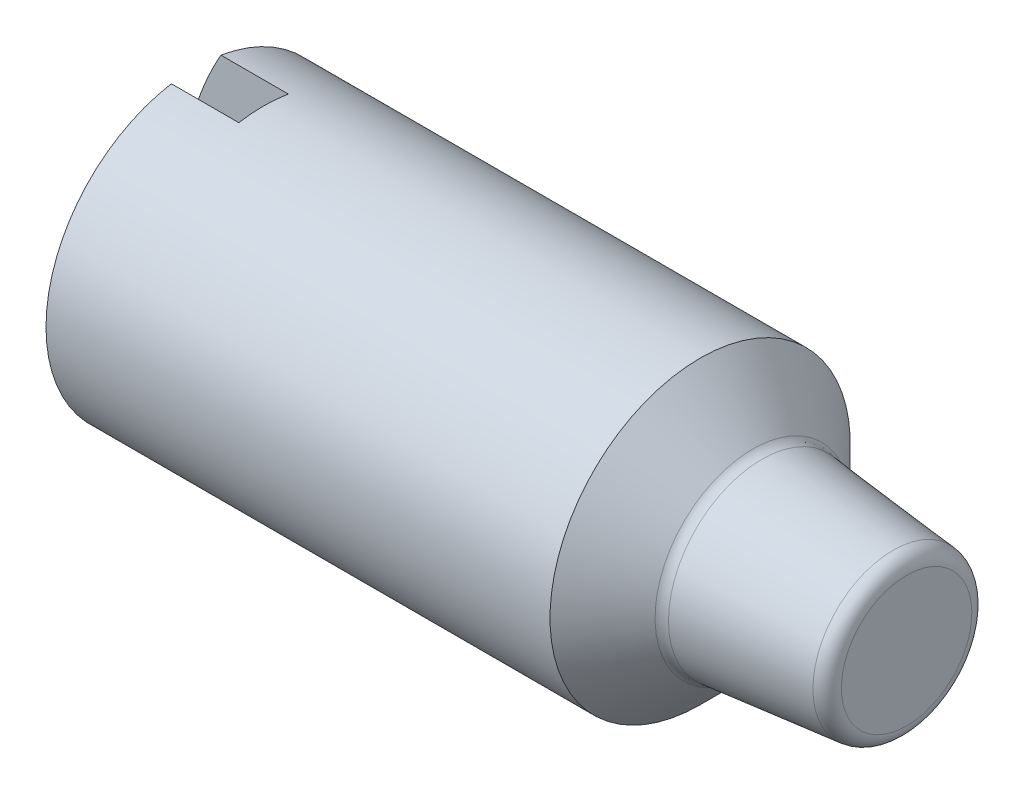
SolidWorks part; units mm, degrees
ref_plane "Front" through (0, 0, 0) normal (0, 0, 1) x (1, 0, 0)
ref_plane "Top" through (0, 0, 0) normal (0, 1, 0) x (1, 0, 0)
ref_plane "Right" through (0, 0, 0) normal (1, 0, 0) x (0, 0, -1)
sketch "Sketch1" plane through (0, 0, 0) normal (0, 0, 1) x (1, 0, 0)
  line L0 (10, 0) -> (0, 0)
  line L1 (10, 0) -> (10, 1.05)
  line L2 (10, 1.05) -> (8, 1.25)
  line L3 (8, 1.25) -> (7.25, 2)
  line L4 (7.25, 2) -> (0.5359, 2)
  line L5 (-8.5703, 0) -> (3.0325, 0) construction
  arc A0 (0.5359, 2) -> (0, 0) centre (4, 0) ccw
  dimension "D2" = 45
  dimension "R" = 4
  dimension "l" = 10
  dimension "d" = 4
  dimension "z" = 2
  dimension "dp" = 2.5
  dimension "d1" = 2.1
revolve "Base" add sketch "Sketch1" angle 360 about L5
sketch "Sketch2" plane through (0, 0, 0) normal (0, 1, 0) x (1, 0, 0)
  line L1 (1.4336, 0.33) -> (0.0136, 0.33)
  line L2 (1.4336, 0.33) -> (1.4336, -0.33)
  line L3 (1.4336, -0.33) -> (0.0136, -0.33)
  arc A0 (0.5359, 2) -> (0.5359, -2) centre (4, 0) ccw construction
  arc A1 (0.0136, -0.33) -> (0.0136, 0.33) centre (0.0136, 0) cw
  dimension "m" = 0.33
  dimension "n" = 0.66
  dimension "t" = 1.42
extrude "Notch" cut sketch "Sketch2" against normal through all and the other way through all
fillet "Fillet" radius 0.2 2 edges at (10, -1.05, 0) (8, -1.25, 0)
sketch "Sketch3" plane through (0, 0, 0) normal (0, 0, 1) x (1, 0, 0)
  line L0 (7.25, 1.567) -> (7.5, 2)
  line L1 (7.5, 2) -> (7.5, 2.5)
  line L2 (7.5, 2.5) -> (7, 2.5)
  line L3 (7, 2.5) -> (7, 2)
  line L4 (7, 2) -> (7.25, 1.567)
  line L5 (0, 0) -> (11.147, 0) construction
  line L7 (7.25, -2) -> (7.25, 2) construction
  line L8 (7.25, 2) -> (0.5359, 2) construction
  dimension "D1" = 0.5
revolve "Cut-Revolve10" [suppressed] cut sketch "Sketch3" angle 360 about L5
pattern_linear "LPattern10" [suppressed] count 12 spacing 0.6 along (1, 0, 0)
equation "\"m@Sketch2\" = \"n@Sketch2\" / 2"
equation "\"d1@Sketch1\" = \"dp@Sketch1\" - \"z@Sketch1\" / 5"
equation "\"D1@Sketch3\" = (  \"d@Sketch1\" - \"D2@ThreadCosmetic1\" )  / 2"
equation "\"D3@LPattern10\" = \"D1@Sketch3\" * 1.2"
equation "\"D1@LPattern10\" = (  \"l@Sketch1\" - \"z@Sketch1\" -  ( \"d@Sketch1\" - \"d1@Sketch1\" )  / 2 )  / \"D3@LPattern10\""
